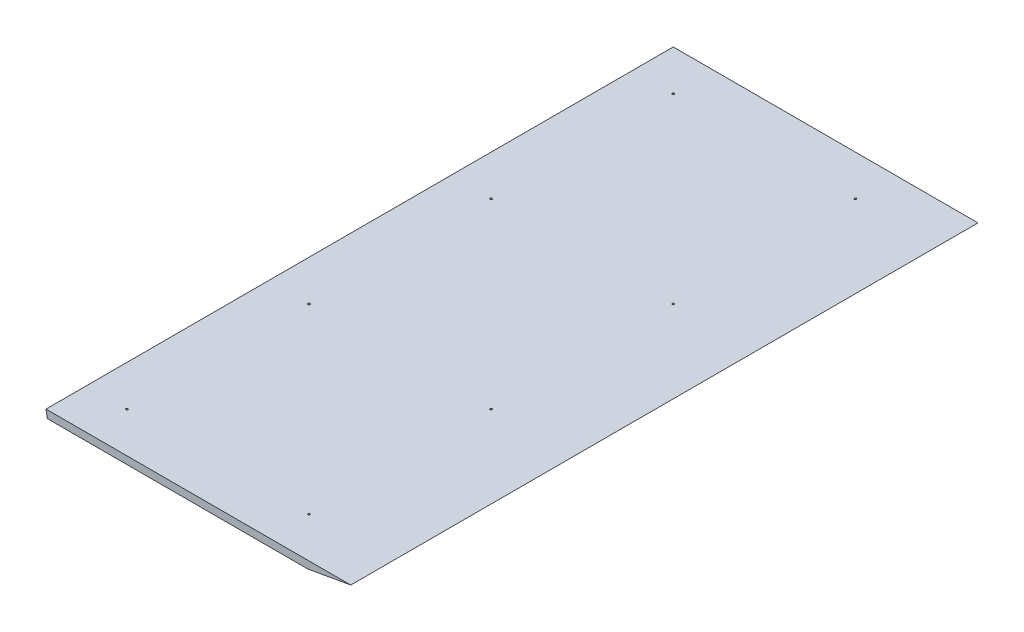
SolidWorks part; units mm, degrees
ref_plane "Front" through (0, 0, 0) normal (0, 0, 1) x (1, 0, 0)
ref_plane "Top" through (0, 0, 0) normal (0, 1, 0) x (1, 0, 0)
ref_plane "Right" through (0, 0, 0) normal (1, 0, 0) x (0, 0, -1)
sketch "Sketch1" plane through (0, 0, 0) normal (0, 1, 0) x (1, 0, 0)
  line L1 (0, 0) -> (765.175, 0)
  line L2 (0, 0) -> (0, 1574.8)
  line L3 (0, 1574.8) -> (765.175, 1574.8)
  line L4 (765.175, 0) -> (765.175, 1574.8)
  dimension "D1" = 1574.8
  dimension "D2" = 765.175
extrude "Boss-Extrude1" add sketch "Sketch1" along normal blind 19.05
sketch "Sketch2" plane through (0, 0, -1574.8) normal (0, 0, -1) x (-1, 0, 0)
  line L0 (-765.175, 19.05) -> (-765.175, 0)
  line L1 (-765.175, 0) -> (-657.1371, 0)
  line L2 (-765.175, 0) -> (0, 0) construction
  line L3 (-657.1371, 0) -> (-765.175, 19.05)
  line L4 (0, 19.05) -> (-3.359, 0)
  line L5 (-3.359, 0) -> (0, 0)
  line L6 (0, 0) -> (0, 19.05)
  line L7 (-765.175, 19.05) -> (0, 19.05) construction
  dimension "D1" = 10
  dimension "D2" = 10
extrude "Cut-Extrude1" cut sketch "Sketch2" against normal through all
sketch "Sketch3" plane through (0, 19.05, 0) normal (0, 1, 0) x (1, 0, 0)
  line L0 (765.175, 1574.8) -> (0, 1574.8) construction
  line L1 (0, 1574.8) -> (0, 0) construction
  point P0 (101.6, 1473.2)
  point P1 (101.6, 1016)
  point P2 (101.6, 558.8)
  point P3 (101.6, 101.6)
  point P4 (558.8, 101.6)
  point P5 (558.8, 558.8)
  point P6 (558.8, 1016)
  point P7 (558.8, 1473.2)
  dimension "D1" = 101.6
  dimension "D2" = 457.2
  dimension "D3" = 457.2
  dimension "D4" = 457.2
  dimension "D5" = 101.6
  dimension "D6" = 457.2
hole_wizard "#8 (0.199) Diameter Hole1" positions "Sketch4" profile "Sketch5" hole size "#8" standard "ANSI Inch"
sketch "Sketch4" plane through (0, 19.05, 0) normal (0, 1, 0) x (1, 0, 0)
  point P0 (101.6, 1473.2)
  point P3 (558.8, 1473.2)
  point P6 (558.8, 1016)
  point P9 (558.8, 558.8)
  point P12 (558.8, 101.6)
  point P15 (101.6, 101.6)
  point P18 (101.6, 558.8)
  point P21 (101.6, 1016)
sketch "Sketch5" plane through (101.6, 19.05, -1473.2) normal (1, 0, 0) x (0, 0, 1)
  line L0 (0, 0) -> (0, 19.05)
  line L1 (0, 19.05) -> (2.5273, 19.05)
  line L2 (2.5273, 19.05) -> (2.5273, 0)
  line L5 (2.5273, 0) -> (0, 0)
  line L11 (0, -6.35) -> (0, 107.95) construction
  dimension "Thru Hole Dia." = 5.0546
  dimension "Thru Hole Depth" = 19.05
